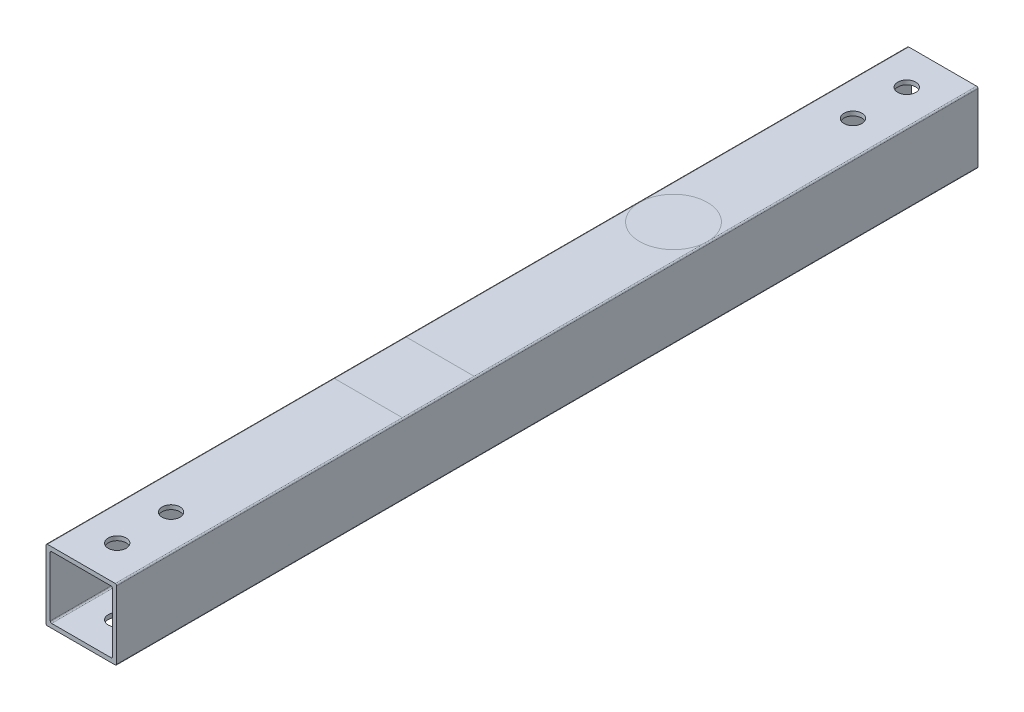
SolidWorks part; units mm, degrees
ref_plane "Front Plane" through (0, 0, 0) normal (0, 0, 1) x (1, 0, 0)
ref_plane "Top Plane" through (0, 0, 0) normal (0, 1, 0) x (1, 0, 0)
ref_plane "Right Plane" through (0, 0, 0) normal (1, 0, 0) x (0, 0, -1)
ref_plane "Plane1" through (0, 0, -2000) normal (0, 0, -1) x (-1, 0, 0)
sketch "Sketch1" plane through (0, 0, -2000) normal (0, 0, -1) x (-1, 0, 0)
  line L0 (11, 10.5) -> (11, -10.5)
  line L1 (10.5, -11) -> (-10.5, -11)
  line L2 (-11, -10.5) -> (-11, 10.5)
  line L3 (-10.5, 11) -> (10.5, 11)
  line L4 (12.5, -12) -> (12.5, 12)
  line L5 (12, 12.5) -> (-12, 12.5)
  line L6 (-12.5, 12) -> (-12.5, -12)
  line L7 (-12, -12.5) -> (12, -12.5)
  line L8 (0, 12.5) -> (0, -12.5) construction
  line L9 (-12.5, 0) -> (12.5, 0) construction
  arc A0 (11, -10.5) -> (10.5, -11) centre (10.5, -10.5) cw
  arc A1 (-10.5, -11) -> (-11, -10.5) centre (-10.5, -10.5) cw
  arc A2 (-11, 10.5) -> (-10.5, 11) centre (-10.5, 10.5) cw
  arc A3 (10.5, 11) -> (11, 10.5) centre (10.5, 10.5) cw
  arc A4 (12.5, 12) -> (12, 12.5) centre (12, 12) ccw
  arc A5 (-12, 12.5) -> (-12.5, 12) centre (-12, 12) ccw
  arc A6 (-12.5, -12) -> (-12, -12.5) centre (-12, -12) ccw
  arc A7 (12, -12.5) -> (12.5, -12) centre (12, -12) ccw
  dimension "D7" = 0.5
  dimension "D8" = 0.5
  dimension "D9" = 0.5
  dimension "D10" = 0.5
  dimension "D11" = 0.5
  dimension "D1" = 25
  dimension "D2" = 25
  dimension "D3" = 1.5
  dimension "D4" = 1.5
  dimension "D5" = 1.5
  dimension "D6" = 1.5
extrude "Boss-Extrude1" add sketch "Sketch1" against normal blind 304.8
sketch "Sketch2" plane through (0, 12.5, 0) normal (0, 1, 0) x (1, 0, 0)
  line L0 (0, 2000) -> (0, 1695.2) construction
  line L1 (-12, 2000) -> (12, 2000) construction
  line L2 (-12, 1695.2) -> (12, 1695.2) construction
  line L3 (-12, 1847.6) -> (12, 1847.6) construction
  line L4 (-12, 1695.2) -> (-12, 2000) construction
  line L5 (12, 1695.2) -> (12, 2000) construction
  circle A0 centre (0, 1987.3) radius 3.175
  circle A1 centre (0, 1968.25) radius 3.175
  circle A2 centre (0, 1707.9) radius 3.175
  circle A3 centre (0, 1726.95) radius 3.175
  dimension "D3" = 6.35
  dimension "D4" = 6.35
  dimension "D1" = 12.7
  dimension "D2" = 31.75
extrude "Cut-Extrude1" cut sketch "Sketch2" against normal up to surface (25 mm away)
sketch "Sketch3" plane through (0, 12.5, 0) normal (0, 1, 0) x (1, 0, 0)
  line L0 (-12, 1822.2) -> (12, 1796.8) construction
  line L3 (-12, 1822.2) -> (12, 1822.2)
  line L4 (-12, 1695.2) -> (-12, 2000) construction
  line L5 (12, 1695.2) -> (12, 2000) construction
  line L6 (12, 1822.2) -> (12, 1796.8)
  line L7 (12, 1796.8) -> (-12, 1796.8)
  line L8 (-12, 1796.8) -> (-12, 1822.2)
  line L9 (-12, 1796.8) -> (12, 1822.2) construction
  line L10 (-12, 1695.2) -> (12, 1695.2) construction
  line L12 (0, 1809.5) -> (0, 2000) construction
  line L13 (-12, 2000) -> (12, 2000) construction
  circle A0 centre (0, 1904.75) radius 12
  point P16 (0, 1904.75)
  dimension "D3" = 24
  dimension "D1" = 25.4
  dimension "D2" = 101.6
